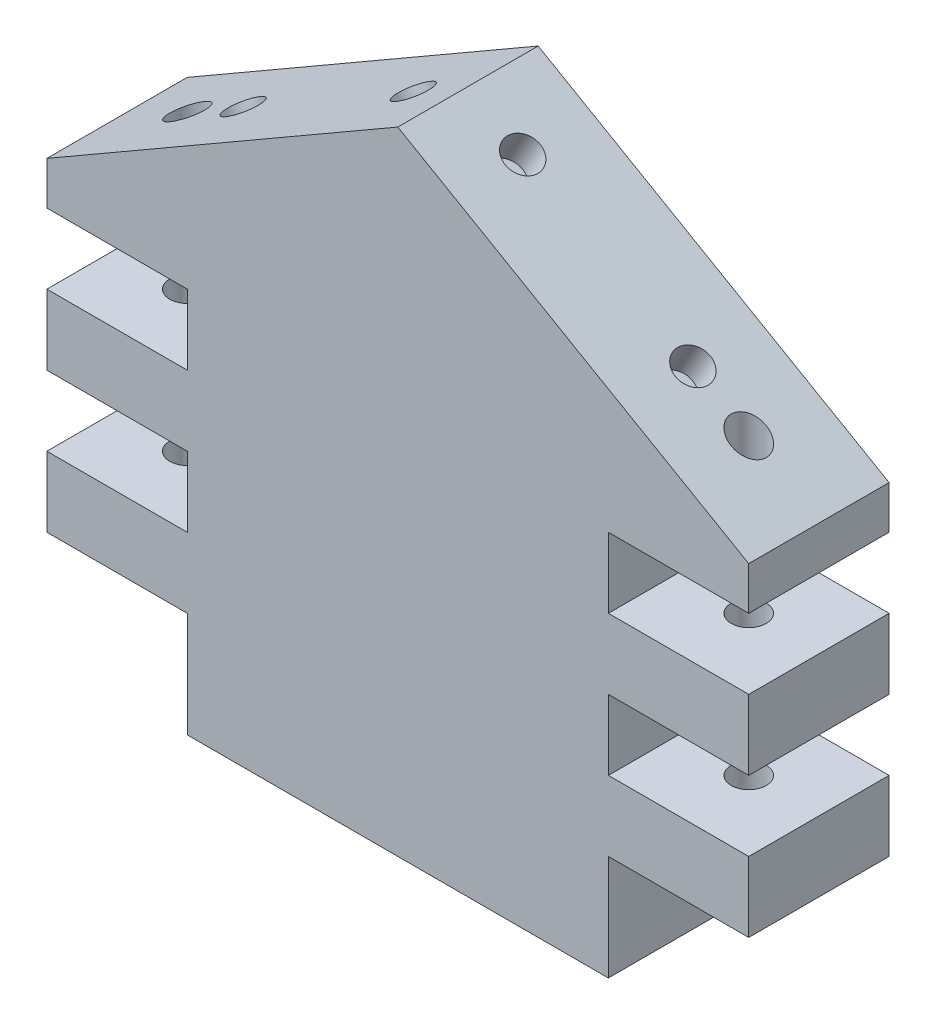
SolidWorks part; units mm, degrees
ref_plane "Front Plane" through (0, 0, 0) normal (0, 0, 1) x (1, 0, 0)
ref_plane "Top Plane" through (0, 0, 0) normal (0, 1, 0) x (1, 0, 0)
ref_plane "Right Plane" through (0, 0, 0) normal (1, 0, 0) x (0, 0, -1)
sketch "Sketch1" plane through (0, 0, 0) normal (0, 0, 1) x (1, 0, 0)
  line L1 (50, -45) -> (-50, -45)
  line L2 (50, -45) -> (50, 45)
  line L3 (50, 45) -> (-50, 45)
  line L4 (-50, -45) -> (-50, 45)
  line L5 (50, -45) -> (-50, 45) construction
  line L6 (50, 45) -> (-50, -45) construction
  point P0 (0, 0)
  dimension "D1" = 100
  dimension "D2" = 90
extrude "Boss-Extrude1" add sketch "Sketch1" along normal mid plane 20 contours L3 L4 L1 L2
sketch "Sketch2" plane through (0, 0, 10) normal (0, 0, 1) x (1, 0, 0)
  line L1 (50, -30) -> (30, -30)
  line L2 (50, -30) -> (50, -45)
  line L3 (50, -45) -> (30, -45)
  line L4 (30, -30) -> (30, -45)
  line L5 (-50, -45) -> (50, -45) construction
  line L6 (50, -45) -> (50, 45) construction
  dimension "D1" = 20
  dimension "D2" = 15
extrude "Cut-Extrude1" cut sketch "Sketch2" against normal through all
sketch "Sketch5" plane through (0, 0, 10) normal (0, 0, 1) x (1, 0, 0)
  line L0 (50, -30) -> (50, 45) construction
  line L1 (50, -10) -> (30, -10)
  line L2 (50, -10) -> (50, -20)
  line L3 (50, -20) -> (30, -20)
  line L4 (30, -10) -> (30, -20)
  line L5 (50, -30) -> (30, -30) construction
  line L6 (30, -30) -> (30, -45) construction
  dimension "D1" = 10
  dimension "D2" = 10
extrude "Cut-Extrude9" cut sketch "Sketch5" against normal through all
pattern_linear "LPattern1" count 2 spacing 20 along (0, 1, 0) of "Cut-Extrude9"
sketch "Sketch3" plane through (-5, -30, 0) normal (0, 1, 0) x (-1, 0, 0)
  line L1 (-55, 10) -> (-35, -10) construction
  circle A0 centre (-45, 0) radius 2.5
  dimension "D1" = 5
extrude "Cut-Extrude2" cut sketch "Sketch3" along normal through all
sketch "Sketch4" plane through (0, 0, 10) normal (0, 0, 1) x (1, 0, 0)
  line L0 (50, 16.1325) -> (0, 45)
  line L1 (50, 10) -> (50, 45) construction
  line L2 (50, 45) -> (-50, 45) construction
  line L3 (0, 45) -> (50, 45)
  line L4 (50, 45) -> (50, 16.1325)
  dimension "D1" = 30
extrude "Cut-Extrude3" cut sketch "Sketch4" against normal through all
mirror "Mirror1" about plane through (0, 0, 0) normal (1, 0, 0) of "Cut-Extrude1", "Cut-Extrude2", "LPattern1", "Cut-Extrude3", "Cut-Extrude9"
sketch "Sketch6" plane through (19.4856, 33.75, 0) normal (0.5, 0.866, 0) x (0.866, -0.5, 0)
  line L0 (-13.5, 0) -> (-22.5, 0) construction
  line L1 (-22.5, 10) -> (-22.5, -10) construction
  circle A0 centre (-13.5, 0) radius 2.5
  dimension "D1" = 5
  dimension "D2" = 9
extrude "Cut-Extrude10" cut sketch "Sketch6" against normal blind 5
pattern_linear "LPattern2" count 2 spacing 28 along (0.866, -0.5, 0) of "Cut-Extrude10"
mirror "Mirror2" about plane through (0, 0, 0) normal (1, 0, 0) of "LPattern2", "Cut-Extrude10"
